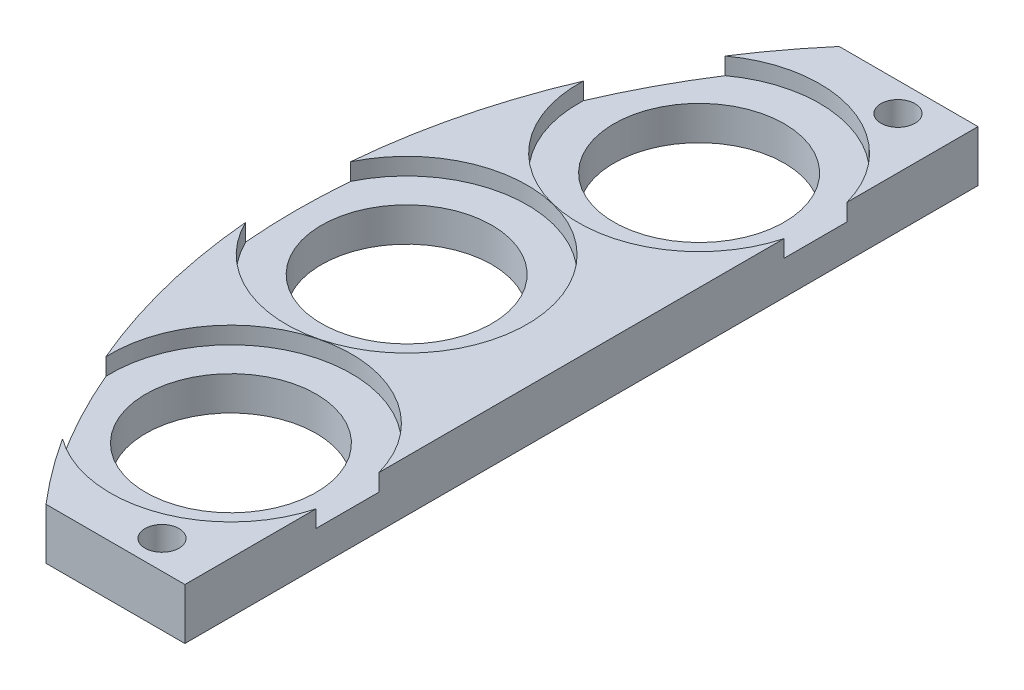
SolidWorks part; units mm, degrees
ref_plane "Front Plane" through (0, 0, 0) normal (0, 0, 1) x (1, 0, 0)
ref_plane "Top Plane" through (0, 0, 0) normal (0, 1, 0) x (1, 0, 0)
ref_plane "Right Plane" through (0, 0, 0) normal (1, 0, 0) x (0, 0, -1)
sketch "Sketch1" plane through (0, 0, 0) normal (0, 1, 0) x (1, 0, 0)
  line L0 (0, 0) -> (-46.4344, 0) construction
  line L1 (0, 0) -> (-40.9991, 21.7996) construction
  line L2 (0, 0) -> (-40.9991, -21.7996) construction
  line L3 (-30.1625, 36.9379) -> (-30.1625, -36.9252)
  line L5 (-43.0872, 36.9379) -> (-30.1625, 36.9379)
  line L6 (-43.0981, -36.9252) -> (-30.1625, -36.9252)
  arc A0 (-43.0872, 36.9379) -> (-43.0981, -36.9252) centre (0, 0) ccw
  circle A1 centre (0, 0) radius 46.4344 construction
  circle A2 centre (-46.4344, 0) radius 7.9375
  circle A3 centre (-40.9991, 21.7996) radius 7.9375
  circle A4 centre (-40.9991, -21.7996) radius 7.9375
  dimension "D1" = 113.5063
  dimension "D2" = 92.8688
  dimension "D3" = 15.875
  dimension "D10" = 21.7996
  dimension "D11" = 21.7996
  dimension "D4" = 28
  dimension "D5" = 28
  dimension "D6" = 30.1625
  dimension "D7" = 73.8632
  dimension "D8" = 36.9252
  dimension "D9" = 36.9379
extrude "Boss-Extrude1" add sketch "Sketch1" along normal blind 4.7625
sketch "Sketch2" plane through (0, 4.7625, 0) normal (0, 1, 0) x (1, 0, 0)
  circle A0 centre (-40.9991, 21.7996) radius 11.2268
  circle A1 centre (-46.4344, 0) radius 11.2268
  circle A2 centre (-40.9991, -21.7996) radius 11.2268
  dimension "D1" = 22.4536
extrude "Cut-Extrude1" cut sketch "Sketch2" against normal blind 1.5875
hole_wizard "1/8 (0.125) Diameter Hole1" positions "Sketch4" profile "Sketch3" hole size "1/8" standard "ANSI Inch"
sketch "Sketch4" plane through (0, 4.7625, 0) normal (0, 1, 0) x (1, 0, 0)
  line L0 (-30.1625, -36.9252) -> (-30.1625, -24.7337) construction
  point P0 (-34.9488, 34.2709)
  point P1 (-34.9488, -34.2709)
  dimension "D1" = 34.2709
  dimension "D2" = 34.2709
  dimension "D3" = 34.9488
  dimension "D4" = 4.7863
sketch "Sketch3" plane through (-34.9488, 4.7625, -34.2709) normal (1, 0, 0) x (0, 0, 1)
  line L0 (0, 0) -> (0, 23.3059)
  line L1 (0, 23.3059) -> (1.5875, 22.352)
  line L2 (1.5875, 22.352) -> (1.5875, 0)
  line L5 (1.5875, 0) -> (0, 0)
  line L10 (0, 23.3059) -> (-1.5875, 22.352) construction
  line L11 (0, -6.35) -> (0, 107.95) construction
  dimension "Hole Dia." = 3.175
  dimension "Hole Depth" = 22.352
  dimension "Drill Angle" = 118
equation "\"Buoyancy\"=\"SW-Volume\"*(\"SW-Density\"-.037062)"
